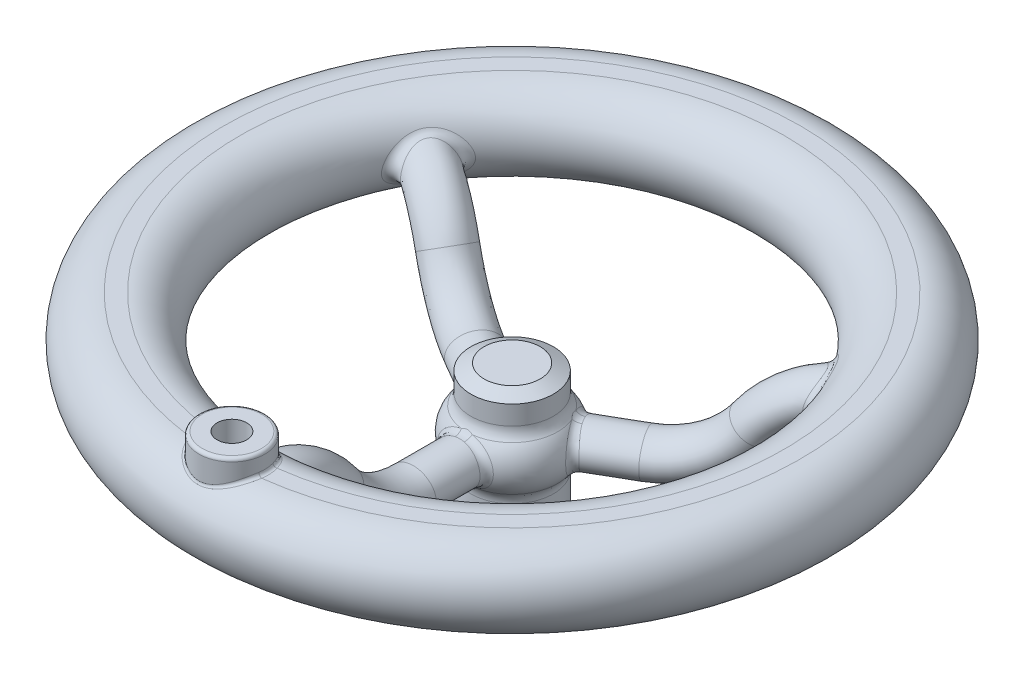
SolidWorks part; units mm, degrees
ref_plane "Front Plane" through (0, 0, 0) normal (0, 0, 1) x (1, 0, 0)
ref_plane "Top Plane" through (0, 0, 0) normal (0, 1, 0) x (1, 0, 0)
ref_plane "Right Plane" through (0, 0, 0) normal (1, 0, 0) x (0, 0, -1)
sketch "Sketch1" plane through (0, 0, 0) normal (1, 0, 0) x (0, 0, -1)
  line L0 (-12.5, 37.198) -> (-12.5, 45)
  line L1 (0, 0) -> (-12.5, 0)
  line L2 (0, 0) -> (0, 45) construction
  line L3 (0, 45) -> (-12.5, 45)
  line L4 (-12.5, 0) -> (-12.5, 16.802)
  line L5 (0, 0) -> (0, 45)
  arc A0 (-13.8333, 33.7987) -> (-13.8333, 20.2013) centre (-6.5, 27) ccw
  arc A1 (-13.8333, 20.2013) -> (-12.5, 16.802) centre (-17.5, 16.802) cw
  arc A2 (-13.8333, 33.7987) -> (-12.5, 37.198) centre (-17.5, 37.198) ccw
  point P10 (-12.5, 19)
  point P13 (-12.5, 35)
  dimension "D6" = 5
  dimension "D1" = 10
  dimension "D2" = 16
  dimension "D3" = 45
  dimension "D4" = 25
  dimension "D5" = 4
revolve "Hub" add sketch "Sketch1" angle 360 about L2
sketch "Sketch2" plane through (0, 0, 0) normal (1, 0, 0) x (0, 0, -1)
  line L0 (-87.5, 51) -> (-82.5, 51) construction
  line L1 (-87.5, 38.5) -> (-82.5, 38.5)
  line L2 (-87.5, 63.5) -> (-82.5, 63.5)
  line L3 (0, 0) -> (0, 89.3139) construction
  line L4 (12.5, 45) -> (-12.5, 45) construction
  arc A0 (-87.5, 38.5) -> (-87.5, 63.5) centre (-87.5, 51) cw
  arc A1 (-82.5, 38.5) -> (-82.5, 63.5) centre (-82.5, 51) ccw
  point P9 (-85, 51)
  dimension "D2" = 30
  dimension "D1" = 25
  dimension "D3" = 170
  dimension "D4" = 6
revolve "Rim" add sketch "Sketch2" angle 360 about L3
sketch "Sketch3" plane through (0, 0, 0) normal (1, 0, 0) x (0, 0, -1)
  line L0 (0, 27) -> (-30, 27)
  line L1 (0, 0) -> (0, 45) construction
  line L2 (-76.9894, 51) -> (-85, 51)
  arc A0 (-30, 27) -> (-53.4947, 39) centre (-30, 56) cw
  arc A1 (-53.4947, 39) -> (-76.9894, 51) centre (-76.9894, 22) ccw
  dimension "D1" = 29
  dimension "D2" = 55
sketch "Sketch4" plane through (0, 0, 0) normal (0, 0, 1) x (1, 0, 0)
  ellipse E0 centre (0, 27) end of major axis (7, 27) minor radius 6
  dimension "D1" = 14
  dimension "D2" = 12
sweep "Spoke" add profiles "Sketch4" path "Sketch3"
pattern_circular "CirPattern1" count 3 over 360 about axis through (0, 0, 0) along (0, 1, 0) of "Spoke"
fillet "Fillet1" radius 3 6 edges at (-9.5075, 25.7108, -13.3833) (-6.8365, 25.7108, 14.9253) (16.344, 25.7108, -1.5421) (-6.9999, 50.1029, 69.6815) (63.9251, 48.7407, -29.0249) (-57.0989, 48.7407, -40.8483)
chamfer "Chamfer1" distance 4 distance2 2 1 edges at (0, 45, -12.5)
sketch "Sketch5" plane through (0, 63.5, 0) normal (0, 1, 0) x (-1, 0, 0)
  line L0 (0, 76.9894) -> (0, 85) construction
  circle A0 centre (0, 85) radius 10
  dimension "D1" = 20
extrude "Extrude1" add sketch "Sketch5" along normal blind 6 and the other way up to next
sketch "Sketch6" plane through (0, 69.5, 0) normal (0, 1, 0) x (-1, 0, 0)
  circle A0 centre (0, 85) radius 4.5
  dimension "D1" = 9
extrude "Cut-Extrude1" cut sketch "Sketch6" against normal through all
fillet "Fillet2" radius 1 5 edges at (-1.8844, 61.1183, 94.8208) (9.9838, 63.5, 84.4304) (-9.9838, 63.5, 84.4304) (1.3626, 61.0784, 75.0933) (0, 69.5, 95)
sketch "Sketch7" plane through (0, 0, 0) normal (0, -1, 0) x (1, 0, 0)
  line L0 (5.1616, 3.6987) -> (5.1616, -3.6987)
  arc A0 (5.1616, 3.6987) -> (5.1616, -3.6987) centre (0, 0) ccw
  dimension "D1" = 12.7
  dimension "D2" = 7.3975
extrude "D-Hole" cut sketch "Sketch7" against normal blind 12.7
